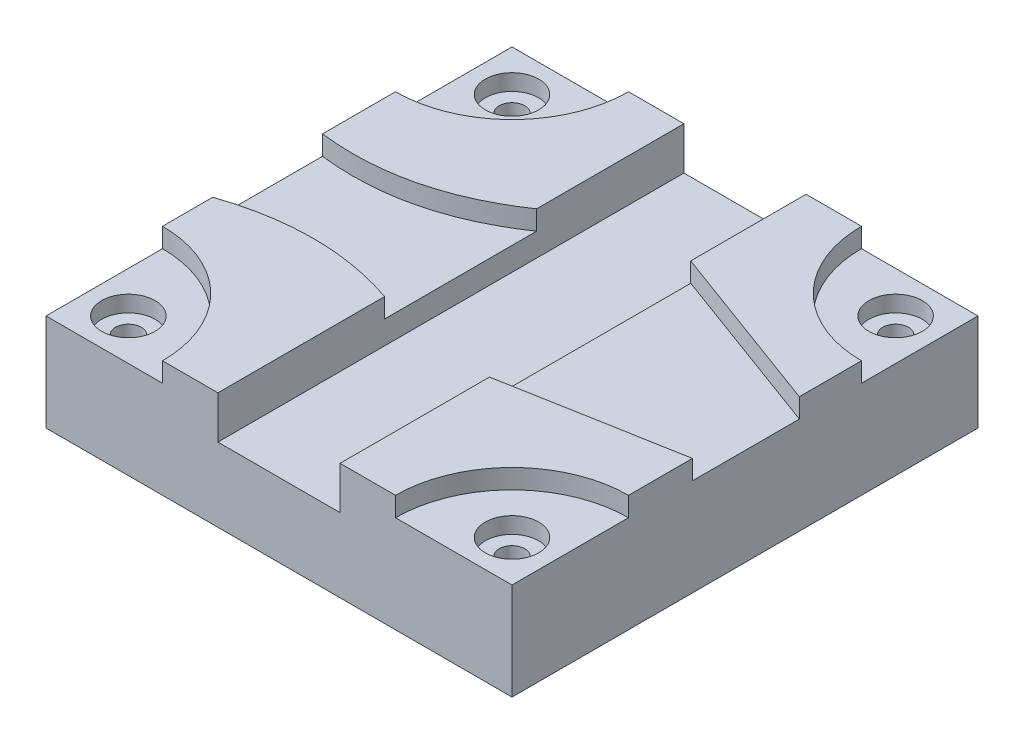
SolidWorks part; units mm, degrees
ref_plane "Front Plane" through (0, 0, 0) normal (0, 0, 1) x (1, 0, 0)
ref_plane "Top Plane" through (0, 0, 0) normal (0, 1, 0) x (1, 0, 0)
ref_plane "Right Plane" through (0, 0, 0) normal (1, 0, 0) x (0, 0, -1)
ref_plane "Plane1" through (0, -38.1, 0) normal (0, -1, 0) x (1, 0, 0)
sketch "Sketch1" plane through (0, -38.1, 0) normal (0, -1, 0) x (1, 0, 0)
  line L0 (-76.2, 16.8721) -> (-19.9773, 16.8721)
  line L1 (-19.9773, 16.8721) -> (-19.9773, 76.2)
  line L2 (-19.9773, 76.2) -> (-76.2, 76.2)
  line L3 (-76.2, 76.2) -> (-76.2, 16.8721)
extrude "Boss-Extrude1" add sketch "Sketch1" against normal blind 31.75
sketch "Sketch2" plane through (0, -6.35, 0) normal (0, 1, 0) x (-1, 0, 0)
  line L0 (19.9773, 76.2) -> (76.2, 76.2)
  line L1 (76.2, 76.2) -> (76.2, 21.6759)
  line L2 (19.9773, 21.6945) -> (19.9773, 76.2)
  spline S0 degree 2 poles (76.2, 21.6759) (48.1338, 12.059) (19.9773, 21.6945) knots 0.129133 0.129133 0.129133 0.772051 0.772051 0.772051
extrude "Boss-Extrude2" add sketch "Sketch2" along normal blind 6.35
sketch "Sketch3" plane through (0, 0, 16.8721) normal (0, 0, -1) x (-1, 0, 0)
  line L0 (19.9773, -6.35) -> (76.2, -6.35)
  line L1 (76.2, -6.35) -> (76.2, -38.1)
  line L2 (76.2, -38.1) -> (19.9773, -38.1)
  line L3 (19.9773, -38.1) -> (19.9773, -6.35)
extrude "Boss-Extrude3" add sketch "Sketch3" along normal blind 93.0721
sketch "Sketch4" plane through (-19.9773, 0, 0) normal (1, 0, 0) x (0, 0, -1)
  line L0 (76.2, 0) -> (76.2, -38.1)
  line L1 (76.2, -38.1) -> (-76.2, -38.1)
  line L2 (-76.2, -38.1) -> (-76.2, 0)
  line L3 (-76.2, 0) -> (76.2, 0)
extrude "Boss-Extrude4" add sketch "Sketch4" along normal blind 96.1773
sketch "Sketch5" plane through (-19.9773, 0, 0) normal (-1, 0, 0) x (0, 0, 1)
  line L0 (76.2, 0) -> (-76.2, 0)
  line L1 (-76.2, 0) -> (-76.2, -13.97)
  line L2 (-76.2, -13.97) -> (76.2, -13.97)
  line L3 (76.2, -13.97) -> (76.2, 0)
extrude "Cut-Extrude1" cut sketch "Sketch5" against normal blind 39.9547
sketch "Sketch6" plane through (0, -6.35, 0) normal (0, 1, 0) x (-1, 0, 0)
  line L0 (76.2, -14.226) -> (76.2, -76.2)
  line L1 (76.2, -76.2) -> (19.9773, -76.2)
  line L2 (19.9773, -76.2) -> (19.9773, -28.0253)
  spline S0 degree 2 poles (19.9773, -28.0253) (45.5451, -10.4993) (76.2, -14.226) knots 0.251643 0.251643 0.251643 0.869679 0.869679 0.869679
extrude "Boss-Extrude5" add sketch "Sketch6" along normal blind 6.35
sketch "Sketch7" plane through (19.9773, 0, 0) normal (-1, 0, 0) x (0, 0, 1)
  line L0 (-38.4698, 0) -> (-38.4698, -6.35)
  line L1 (-38.4698, -6.35) -> (27.3375, -6.35)
  line L2 (27.3375, -6.35) -> (27.3375, 0)
  line L3 (27.3375, 0) -> (-38.4698, 0)
extrude "Cut-Extrude2" cut sketch "Sketch7" against normal through all
draft "Draft1" type of draft neutral plane draft angle 10.242 faces to draft 1 parameters "D1"=10.242
draft "Draft2" type of draft neutral plane draft angle 20.202 faces to draft 1 parameters "D1"=20.202
hole_wizard "M72 Clearance Hole1" positions "Sketch9" profile "Sketch8" hole size "M72" standard "ANSI Metric"
sketch "Sketch9" plane through (0, 0, 0) normal (0, 1, 0) x (1, 0, 0)
  point P0 (-76.2, 76.2)
  point P1 (76.2, 76.2)
  point P2 (76.2, -76.2)
  point P3 (-76.2, -76.2)
sketch "Sketch8" plane through (-76.2, 0, -76.2) normal (1, 0, 0) x (0, 0, 1)
  line L0 (0, 0) -> (0, 6.35)
  line L1 (0, 6.35) -> (38.1, 6.35)
  line L2 (38.1, 6.35) -> (38.1, 0)
  line L5 (38.1, 0) -> (0, 0)
  line L10 (0, 6.35) -> (-38.1, 6.35) construction
  line L11 (0, -6.35) -> (0, 107.95) construction
  dimension "Hole Dia." = 76.2
  dimension "Hole Depth" = 6.35
  dimension "Drill Angle" = 180
hole_wizard "CBORE for M8 Hex Head Bolt1" positions "Sketch11" profile "Sketch10" counterbore size "M8" standard "ANSI Metric"
sketch "Sketch11" plane through (0, -6.35, 0) normal (0, 1, 0) x (1, 0, 0)
  point P0 (-62.7296, 62.7296)
  point P1 (62.7296, 62.7296)
  point P2 (62.7296, -62.7296)
  point P3 (-62.7296, -62.7296)
sketch "Sketch10" plane through (-62.7296, -6.35, -62.7296) normal (1, 0, 0) x (0, 0, 1)
  line L0 (0, 0) -> (0, 31.75)
  line L1 (0, 31.75) -> (4.2164, 31.75)
  line L3 (4.2164, 31.75) -> (4.2164, 5.3086)
  line L4 (4.2164, 5.3086) -> (8.7312, 5.3086)
  line L5 (8.7312, 5.3086) -> (8.7312, 0)
  line L7 (8.7312, 0) -> (0, 0)
  line L11 (0, -6.35) -> (0, 107.95) construction
  dimension "Thru Hole Dia." = 8.4328
  dimension "Thru Hole Depth" = 31.75
  dimension "C'Bore Dia." = 17.4625
  dimension "C'Bore Depth" = 5.3086
